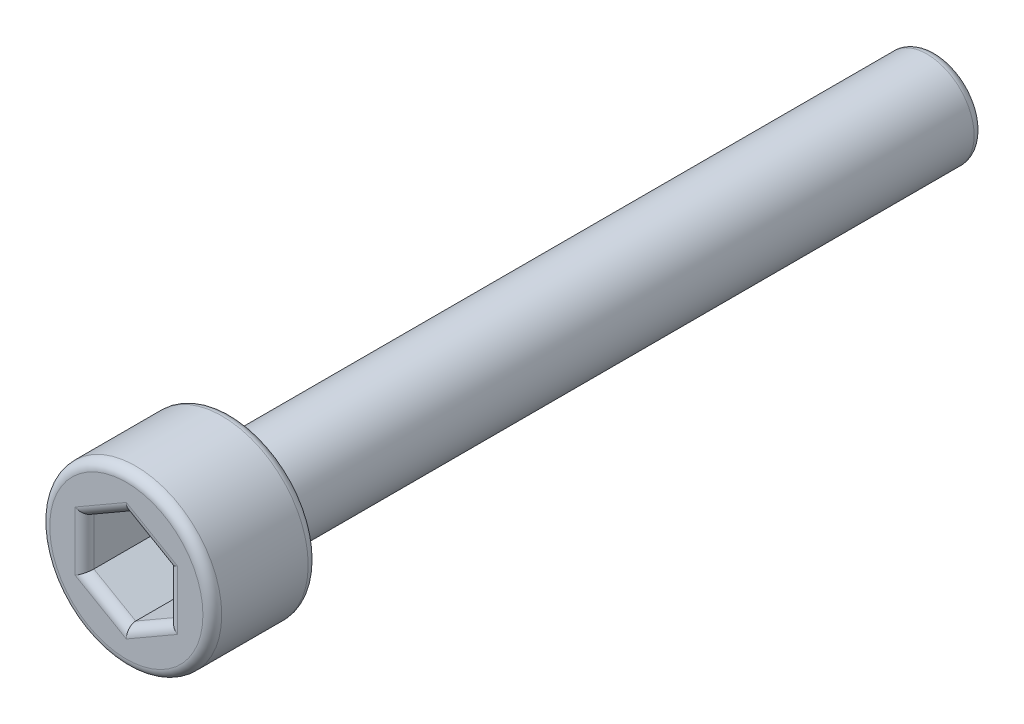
SolidWorks part; units mm, degrees
ref_plane "Front Plane" through (0, 0, 0) normal (0, 0, 1) x (1, 0, 0)
ref_plane "Top Plane" through (0, 0, 0) normal (0, 1, 0) x (1, 0, 0)
ref_plane "Right Plane" through (0, 0, 0) normal (1, 0, 0) x (0, 0, -1)
sketch "Sketch1" plane through (0, 0, 0) normal (0, 0, 1) x (1, 0, 0)
  circle A0 centre (0, 0) radius 1.27
  dimension "D1" = 2.54
extrude "Extrude1" add sketch "Sketch1" along normal blind 19.05
sketch "Sketch2" plane through (0, 0, 19.05) normal (0, 0, 1) x (1, 0, 0)
  circle A0 centre (0, 0) radius 2.3241
  dimension "D1" = 4.6482
extrude "Extrude2" add sketch "Sketch2" along normal blind 2.8448
sketch "Sketch3" plane through (0, 0, 21.8948) normal (0, 0, 1) x (1, 0, 0)
  line L1 (0, -1.3048) -> (1.13, -0.6524)
  line L2 (1.13, -0.6524) -> (1.13, 0.6524)
  line L3 (1.13, 0.6524) -> (0, 1.3048)
  line L4 (0, 1.3048) -> (-1.13, 0.6524)
  line L5 (-1.13, 0.6524) -> (-1.13, -0.6524)
  line L6 (-1.13, -0.6524) -> (0, -1.3048)
  circle A0 centre (0, 0) radius 1.13 construction
extrude "Cut-Extrude1" cut sketch "Sketch3" against normal blind 2.032
fillet "Fillet1" radius 0.254 6 edges at (-0.565, -0.9786, 21.8948) (0.565, -0.9786, 21.8948) (1.13, 0, 21.8948) (0.565, 0.9786, 21.8948) (-0.565, 0.9786, 21.8948) (-1.13, 0, 21.8948)
fillet "Fillet2" radius 0.254 2 edges at (2.3241, 0, 19.05) (2.3241, 0, 21.8948)
fillet "Fillet3" radius 0.254 1 edges at (1.27, 0, 0)
